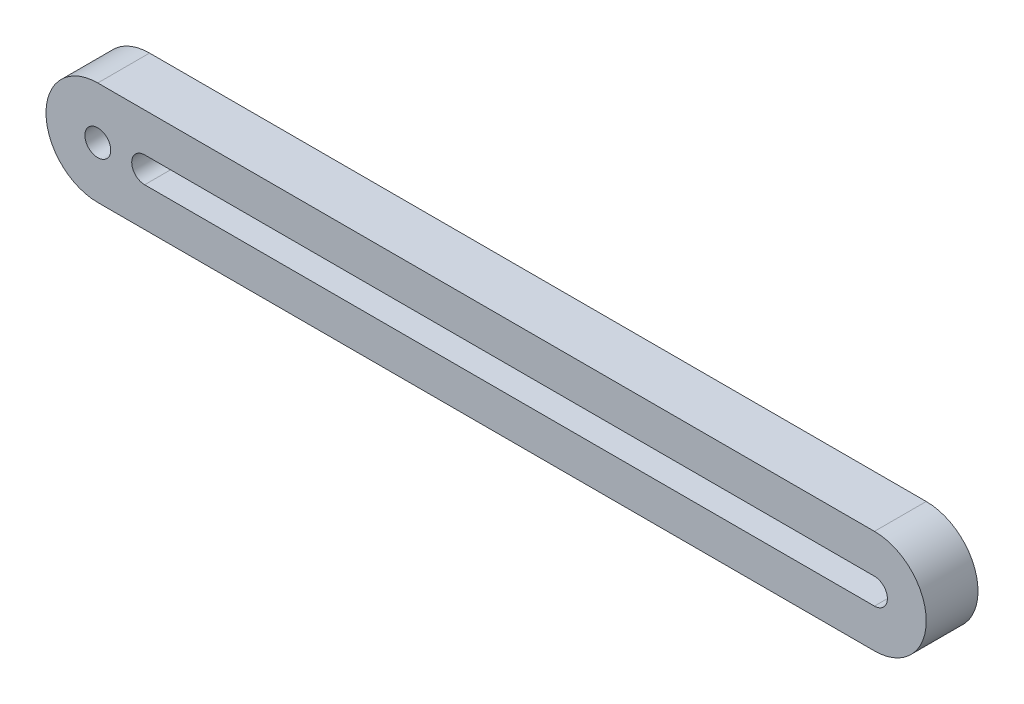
SolidWorks part; units mm, degrees
ref_plane "Front Plane" through (0, 0, 0) normal (0, 0, 1) x (1, 0, 0)
ref_plane "Top Plane" through (0, 0, 0) normal (0, 1, 0) x (1, 0, 0)
ref_plane "Right Plane" through (0, 0, 0) normal (1, 0, 0) x (0, 0, -1)
sketch "Sketch1" plane through (0, 0, 0) normal (0, 0, 1) x (1, 0, 0)
  line L0 (0, 0) -> (38.1, 0) construction
  line L1 (0, 2.54) -> (38.1, 2.54)
  line L2 (0, -2.54) -> (38.1, -2.54)
  arc A0 (0, 2.54) -> (0, -2.54) centre (0, 0) ccw
  arc A1 (38.1, -2.54) -> (38.1, 2.54) centre (38.1, 0) ccw
  point P3 (19.05, 0)
  dimension "D1" = 2.54
  dimension "D2" = 38.1
extrude "Boss-Extrude1" add sketch "Sketch1" along normal blind 2.54
sketch "Sketch2" plane through (0, 0, 2.54) normal (0, 0, 1) x (1, 0, 0)
  circle A0 centre (0, 0) radius 0.635
  dimension "D1" = 1.27
extrude "Cut-Extrude1" cut sketch "Sketch2" against normal through all both and the other way through all
ref_plane "Plane1" through (19.05, 0, 0) normal (1, 0, 0) x (0, 0, -1)
mirror "Mirror1" about plane through (19.05, 0, 0) normal (1, 0, 0) of "Cut-Extrude1"
sketch "Sketch3" plane through (0, 0, 2.54) normal (0, 0, 1) x (1, 0, 0)
  line L0 (2.3, 0) -> (38.1, 0) construction
  line L3 (2.3, 0.635) -> (38.1, 0.635)
  line L4 (2.3, -0.635) -> (38.1, -0.635)
  arc A2 (2.3, 0.635) -> (2.3, -0.635) centre (2.3, 0) ccw
  arc A3 (38.1, -0.635) -> (38.1, 0.635) centre (38.1, 0) ccw
  point P5 (20.2, 0)
extrude "Cut-Extrude2" cut sketch "Sketch3" against normal through all both and the other way through all
